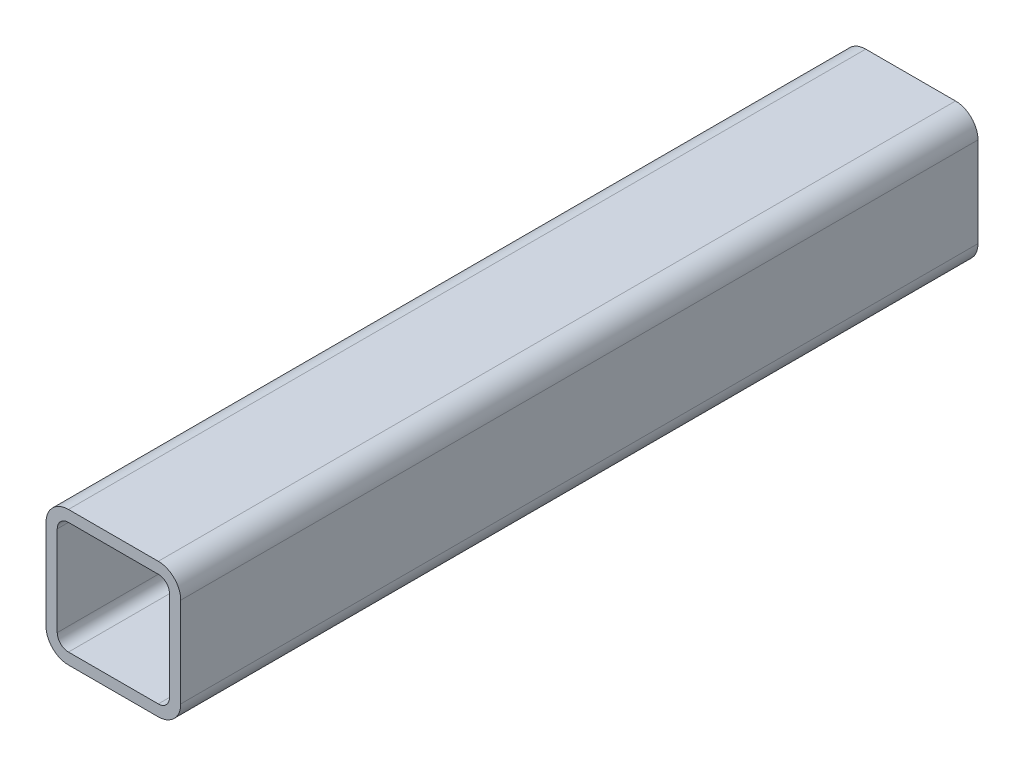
SolidWorks part; units mm, degrees
ref_plane "Front" through (0, 0, 0) normal (0, 0, 1) x (1, 0, 0)
ref_plane "Top" through (0, 0, 0) normal (0, 1, 0) x (1, 0, 0)
ref_plane "Right" through (0, 0, 0) normal (1, 0, 0) x (0, 0, -1)
sketch "Sketch1" plane through (0, 0, 0) normal (0, 0, 1) x (1, 0, 0)
  line L0 (-25.4, 38.1) -> (25.4, 38.1)
  line L1 (-38.1, 25.4) -> (-38.1, -25.4)
  line L2 (25.4, -38.1) -> (-25.4, -38.1)
  line L3 (38.1, -25.4) -> (38.1, 25.4)
  line L4 (0, -38.1) -> (0, 38.1) construction
  arc A0 (-38.1, 25.4) -> (-25.4, 38.1) centre (-25.4, 25.4) cw
  arc A1 (-25.4, -38.1) -> (-38.1, -25.4) centre (-25.4, -25.4) cw
  arc A2 (38.1, -25.4) -> (25.4, -38.1) centre (25.4, -25.4) cw
  arc A3 (38.1, 25.4) -> (25.4, 38.1) centre (25.4, 25.4) ccw
  dimension "D1" = 12.7
  dimension "D2" = 76.2
  dimension "D3" = 76.2
extrude "Base-Extrude-Thin" add sketch "Sketch1" along normal blind 450.85 thin
